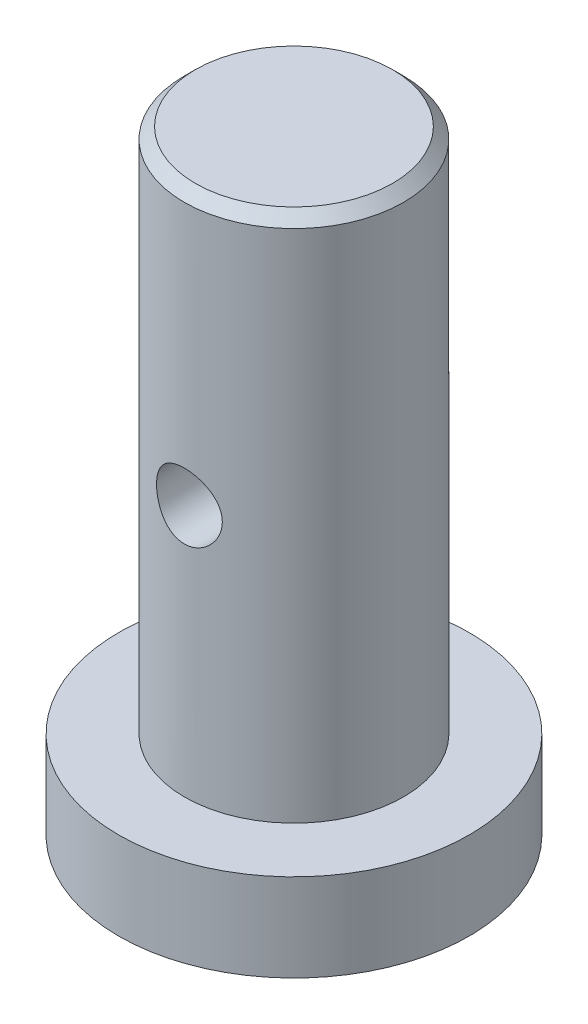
SolidWorks part; units mm, degrees
ref_plane "Face" through (0, 0, 0) normal (0, 0, 1) x (1, 0, 0)
ref_plane "Dessus" through (0, 0, 0) normal (0, 1, 0) x (1, 0, 0)
ref_plane "Droite" through (0, 0, 0) normal (1, 0, 0) x (0, 0, -1)
sketch "Esquisse1" plane through (0, 0, 0) normal (0, 0, 1) x (1, 0, 0)
  line L0 (0, 28) -> (0, 0)
  line L1 (0, 0) -> (8, 0)
  line L2 (8, 0) -> (8, 4)
  line L3 (8, 4) -> (5, 4)
  line L4 (5, 4) -> (5, 28)
  line L5 (0, 28) -> (5, 28)
  line L6 (0, 103.5911) -> (0, -79.9131) construction
  dimension "D1" = 24
  dimension "D2" = 4
  dimension "D3" = 5
  dimension "D4" = 8
revolve "Base-Révolution" add sketch "Esquisse1" angle 360 about L6
chamfer "Chanfrein1" distance 0.5 angle 45
sketch "Esquisse2" plane through (0, 0, 0) normal (0, 0, 1) x (1, 0, 0)
  line L0 (0, 29.7096) -> (0, 1.2904) construction
  line L1 (5, 4) -> (5, 27.5) construction
  line L2 (-5, 27.5) -> (-5, 4) construction
  line L3 (8, 4) -> (-8, 4) construction
  circle A0 centre (0, 15.5) radius 1.5
  dimension "D1" = 3
  dimension "D2" = 11.5
extrude "Enlèv. mat.-Extru.1" cut sketch "Esquisse2" against normal through all and the other way through all
